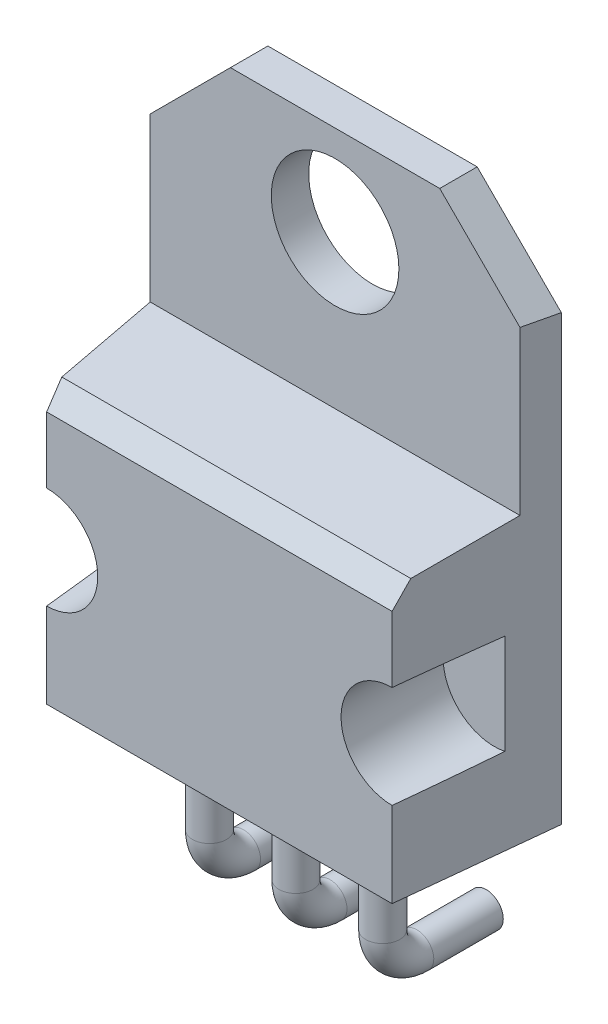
SolidWorks part; units mm, degrees
ref_plane "Face" through (0, 0, 0) normal (0, 0, 1) x (1, 0, 0)
ref_plane "Dessus" through (0, 0, 0) normal (0, 1, 0) x (1, 0, 0)
ref_plane "Droite" through (0, 0, 0) normal (1, 0, 0) x (0, 0, -1)
sketch "Esquisse1" plane through (0, 0, 0) normal (0, 0, 1) x (1, 0, 0)
  line L1 (0, 0) -> (10.15, 0)
  line L2 (0, 0) -> (0, 15.5)
  line L3 (0, 15.5) -> (10.15, 15.5)
  line L4 (10.15, 0) -> (10.15, 15.5)
  dimension "D1" = 10.15
  dimension "D2" = 15.5
extrude "Extrusion1" add sketch "Esquisse1" along normal blind 1.1
sketch "Esquisse2" plane through (0, 0, 1.1) normal (0, 0, 1) x (1, 0, 0)
  line L0 (5.075, 15.5) -> (5.075, 0) construction
  line L1 (10.15, 15.5) -> (0, 15.5) construction
  line L2 (0, 0) -> (10.15, 0) construction
  circle A0 centre (5.075, 12.85) radius 1.875
  dimension "D1" = 3.75
  dimension "D2" = 2.65
extrude "Enlèv. mat.-Extru.1" cut sketch "Esquisse2" against normal through all
chamfer "Chanfrein1" distance 2 angle 45 2 edges at (10.15, 15.5, 0.55) (0, 15.5, 0.55)
sketch "Esquisse3" plane through (0, 0, 1.1) normal (0, 0, 1) x (1, 0, 0)
  line L0 (10.15, 0) -> (10.15, 13.5) construction
  line L1 (0, 0) -> (10.15, 0)
  line L2 (0, 0) -> (0, 8)
  line L3 (0, 8) -> (10.15, 8)
  line L4 (10.15, 0) -> (10.15, 8)
  dimension "D1" = 8
extrude "Extrusion2" add sketch "Esquisse3" along normal blind 3.4
sketch "Esquisse4" plane through (0, 0, 4.5) normal (0, 0, 1) x (1, 0, 0)
  line L0 (0, 8) -> (0, 0) construction
  line L1 (10.15, 0) -> (10.15, 8) construction
  circle A0 centre (0, 4) radius 1.5
  circle A1 centre (10.15, 4) radius 1.5
  dimension "D1" = 3
extrude "Enlèv. mat.-Extru.2" cut sketch "Esquisse4" against normal blind 3
draft "Dépouille1" type of draft neutral plane draft angle 6 faces to draft 3 parameters "D1"=6
chamfer "Chanfrein2" distance 0.5 angle 45 1 edges at (5.075, 8, 4.5)
sketch "Esquisse5" plane through (0, 0, 0) normal (0, -1, 0) x (1, 0, 0)
  line L0 (10.3865, 2.25) -> (-0.2365, 2.25) construction
  line L1 (10.15, 4.5) -> (10.623, 0) construction
  line L2 (0, 4.5) -> (-0.473, 0) construction
  line L3 (5.075, 4.5) -> (5.075, 0) construction
  line L4 (0, 4.5) -> (10.15, 4.5) construction
  line L5 (-0.473, 0) -> (10.623, 0) construction
  circle A2 centre (2.535, 2.25) radius 0.5
ref_plane "Plan1" through (2.54, 0, 0) normal (1, 0, 0) x (0, 0, -1)
sketch "Esquisse8" plane through (2.54, 0, 0) normal (1, 0, 0) x (0, 0, -1)
  line L0 (0, -0.3289) -> (0, -5.6814) construction
  line L1 (1.1833, -4.05) -> (-3.597, -4.05) construction
  line L2 (1.1833, 0) -> (-3.2267, 0) construction
  line L3 (-2.25, 1.186) -> (-2.25, -5.6814) construction
  line L4 (-2.25, 0) -> (-2.25, -3.05)
  line L5 (-1.25, -4.05) -> (0.792, -4.05)
  arc A0 (-2.25, -3.05) -> (-1.25, -4.05) centre (-1.25, -3.05) ccw
  dimension "D3" = 1
  dimension "D1" = 2.25
  dimension "D2" = 4.05
sweep "Balayage1" add profiles "Esquisse5" path "Esquisse8"
sketch "Esquisse9" plane through (0, 0, 0) normal (0, -1, 0) x (1, 0, 0)
  line L0 (5.075, -0.3913) -> (5.075, 6.4257) construction
  line L1 (-2.5677, 0) -> (13.037, 0) construction
  line L2 (13.037, 2.25) -> (-3.6328, 2.25) construction
  circle A0 centre (5.075, 2.25) radius 0.5
  dimension "D1" = 2.25
ref_plane "Plan2" through (5.08, 0, 0) normal (1, 0, 0) x (0, 0, -1)
sketch "Esquisse10" plane through (5.08, 0, 0) normal (1, 0, 0) x (0, 0, -1)
  line L0 (0.792, -5.5725) -> (0.792, -2.1485) construction
  line L1 (1.4127, -4.05) -> (-3.8327, -4.05) construction
  line L2 (-2.25, 0.8142) -> (-2.25, -6.301) construction
  line L3 (-2.25, 0) -> (-2.25, -3.05)
  line L4 (-1.25, -4.05) -> (0.792, -4.05)
  arc A0 (-2.25, -3.05) -> (-1.25, -4.05) centre (-1.25, -3.05) ccw
  dimension "D1" = 1
sweep "Balayage2" add profiles "Esquisse9" path "Esquisse10"
mirror "Symétrie1" about plane through (5.08, 0, 0) normal (1, 0, 0) of "Balayage1"
